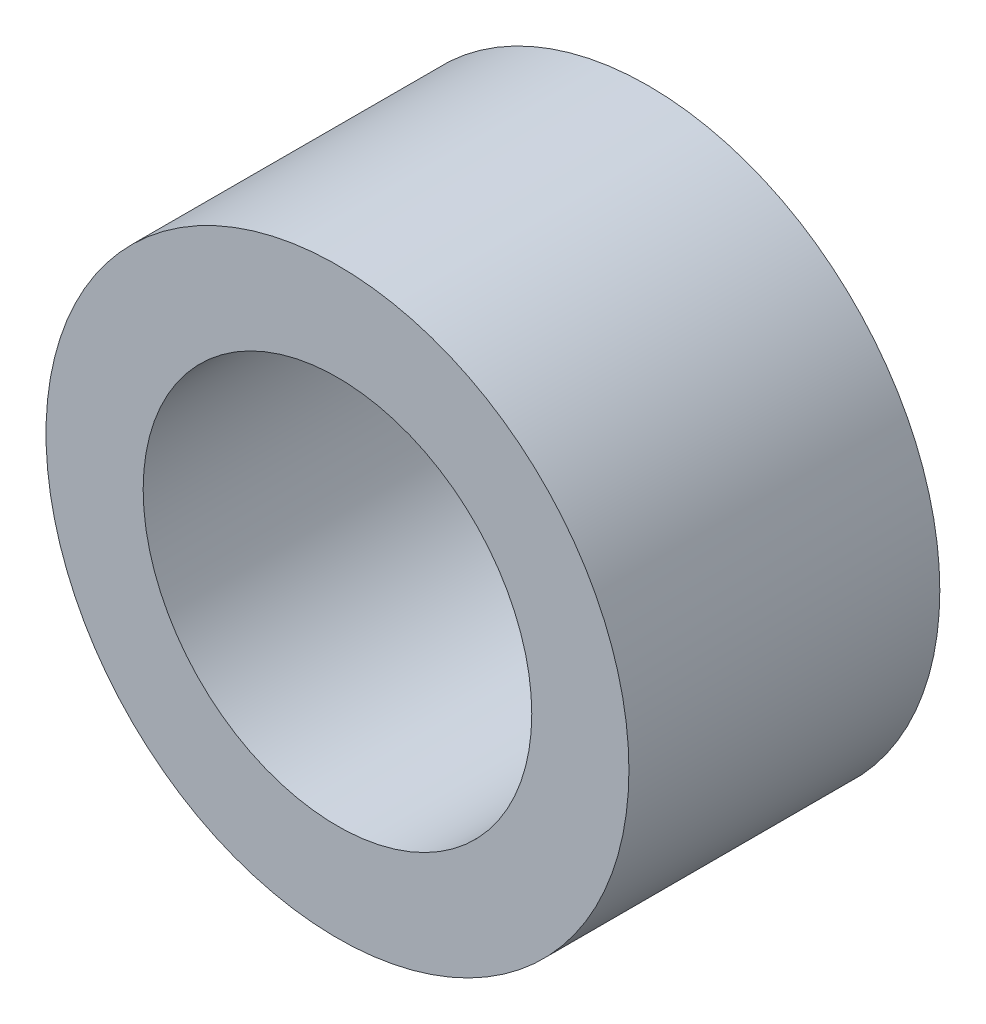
SolidWorks part; units mm, degrees
ref_plane "Face" through (0, 0, 0) normal (0, 0, 1) x (1, 0, 0)
ref_plane "Dessus" through (0, 0, 0) normal (0, 1, 0) x (1, 0, 0)
ref_plane "Droite" through (0, 0, 0) normal (1, 0, 0) x (0, 0, -1)
sketch "Esquisse1" plane through (0, 0, 0) normal (0, 0, 1) x (1, 0, 0)
  circle A0 centre (0, 0) radius 10
  circle A1 centre (0, 0) radius 15
  circle A2 centre (0, 0) radius 15 construction
  dimension "D1" = 20
extrude "Base-Extrusion" add sketch "Esquisse1" against normal up to surface (16 mm away)
